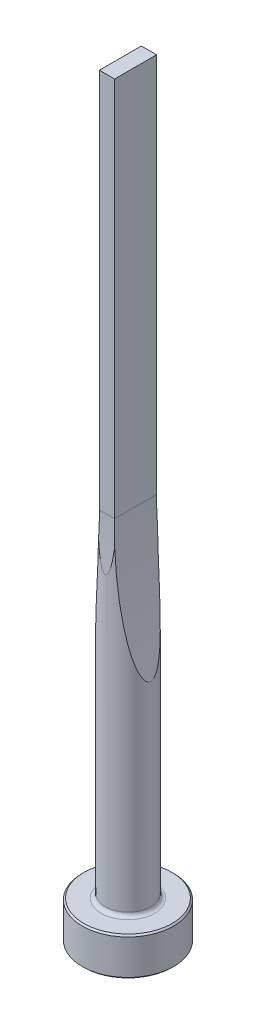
SolidWorks part; units mm, degrees
ref_plane "Front Plane" through (0, 0, 0) normal (0, 0, 1) x (1, 0, 0)
ref_plane "Top Plane" through (0, 0, 0) normal (0, 1, 0) x (1, 0, 0)
ref_plane "Right Plane" through (0, 0, 0) normal (1, 0, 0) x (0, 0, -1)
sketch "Sketch1" plane through (0, 0, 0) normal (0, 0, 1) x (1, 0, 0)
  line L0 (0, 0) -> (5.8, 0)
  line L1 (55, 0) -> (-55, 0) construction
  line L2 (6, 0.2) -> (6, 4.8)
  line L3 (5.8, 5) -> (3.5, 5)
  line L4 (3, 5.5) -> (3, 100)
  line L5 (0, 100) -> (3, 100)
  line L6 (6, 4.8) -> (5.8, 5)
  line L7 (5.8, 0) -> (6, 0.2)
  line L8 (0, 100) -> (0, 0)
  arc A0 (3, 5.5) -> (3.5, 5) centre (3.5, 5.5) ccw
  point P1 (6, 0)
  point P6 (6, 5)
  dimension "D4" = 0.5
  dimension "D1" = 3
  dimension "D2" = 6
  dimension "D3" = 5
  dimension "D5" = 100
revolve "Revolve1" add sketch "Sketch1" angle 360 about L8
sketch "Sketch2" plane through (0, 0, 0) normal (0, 0, 1) x (1, 0, 0)
  line L0 (1, 100) -> (1, 50)
  line L1 (3, 100) -> (-3, 100) construction
  line L2 (-1, 100) -> (-1, 50)
  line L3 (3, 100) -> (3, 31.132)
  line L4 (-3, 100) -> (-3, 31.132)
  line L5 (0, -6.6) -> (0, 6.6) construction
  line L6 (3, 100) -> (1, 100)
  line L8 (-1, 100) -> (-3, 100)
  arc A0 (1, 50) -> (3, 31.132) centre (91, 50) ccw
  arc A1 (-1, 50) -> (-3, 31.132) centre (-91, 50) cw
  dimension "D4" = 90
  dimension "D1" = 50
  dimension "D2" = 2
  dimension "D3" = 1
extrude "Cut-Extrude1" cut sketch "Sketch2" against normal mid plane 10
sketch "Sketch3" plane through (0, 0, 0) normal (1, 0, 0) x (0, 0, -1)
  line L0 (2.75, 100) -> (2.75, 50)
  line L1 (-2.8284, 100) -> (2.8284, 100) construction
  line L2 (-2.75, 100) -> (-2.75, 50)
  line L3 (3, 100) -> (3, 43.2965)
  line L4 (2.75, 100) -> (3, 100)
  line L5 (0, 6.6) -> (0, -6.6) construction
  line L6 (-3, 100) -> (-3, 43.2965)
  line L8 (-2.75, 100) -> (-3, 100)
  arc A0 (2.75, 50) -> (3, 43.2965) centre (92.75, 50) ccw
  arc A1 (-2.75, 50) -> (-3, 43.2965) centre (-92.75, 50) cw
  dimension "D2" = 90
  dimension "D1" = 50
  dimension "D3" = 5.5
  dimension "D4" = 2.75
extrude "Cut-Extrude2" cut sketch "Sketch3" against normal mid plane 10
